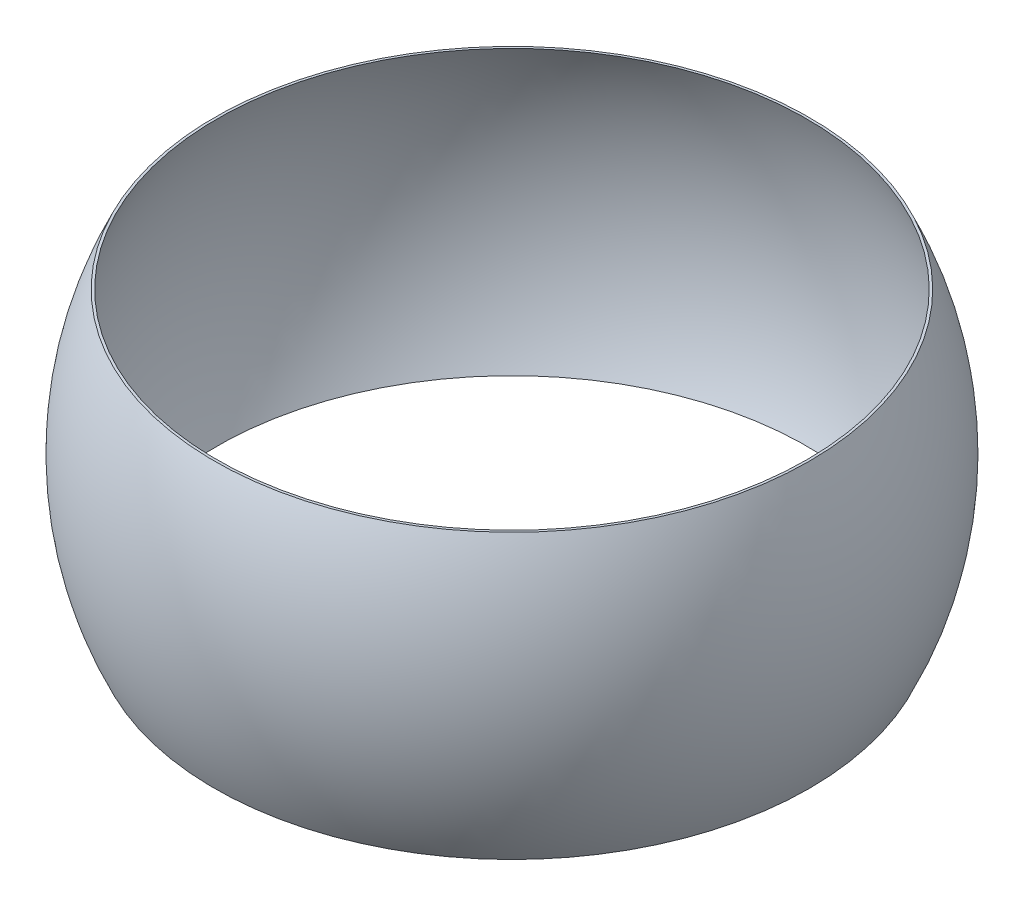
SolidWorks part; units mm, degrees
ref_plane "Front" through (0, 0, 0) normal (0, 0, 1) x (1, 0, 0)
ref_plane "Top" through (0, 0, 0) normal (0, 1, 0) x (1, 0, 0)
ref_plane "Right" through (0, 0, 0) normal (1, 0, 0) x (0, 0, -1)
sketch "Sketch1" plane through (0, 0, 0) normal (0, 0, 1) x (1, 0, 0)
  line L0 (6.7429, 3.2385) -> (6.7992, 3.2385)
  line L1 (6.7429, -3.2385) -> (6.7992, -3.2385)
  line L2 (0, 5.3982) -> (0, -4.7914) construction
  arc A0 (6.7992, -3.2385) -> (6.7992, 3.2385) centre (0, 0) ccw
  arc A1 (6.7429, -3.2385) -> (6.7429, 3.2385) centre (0, 0) ccw
  dimension "D1" = 15.0622
  dimension "D3" = 6.477
  dimension "D2" = 0.0508
revolve "Revolve1" add sketch "Sketch1" angle 360 about L2
